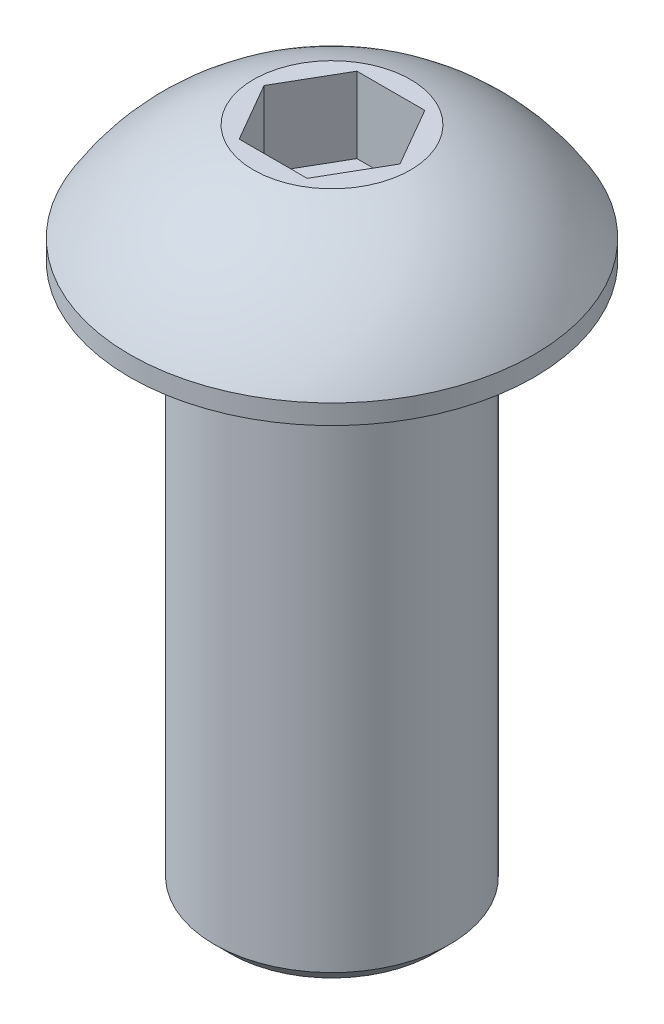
SolidWorks part; units mm, degrees
ref_plane "Front" through (0, 0, 0) normal (0, 0, 1) x (1, 0, 0)
ref_plane "Top" through (0, 0, 0) normal (0, 1, 0) x (1, 0, 0)
ref_plane "Right" through (0, 0, 0) normal (1, 0, 0) x (0, 0, -1)
sketch "Sketch1" plane through (0, 0, 0) normal (0, 0, 1) x (1, 0, 0)
  line L0 (5.15, 0) -> (0, 0)
  line L1 (0, 0) -> (0, 3)
  line L2 (0, 3) -> (2, 3)
  line L3 (5.15, 0) -> (5.15, 0.5)
  line L4 (0, 2.4641) -> (0, -1.3782) construction
  arc A0 (2, 3) -> (5.15, 0.5) centre (0.2848, -2.3957) cw
  dimension "D5" = 0.2848
  dimension "D1" = 3
  dimension "D2" = 5.15
  dimension "D3" = 2
  dimension "D4" = 0.5
revolve "Base-Revolve" add sketch "Sketch1" angle 360 about L4
sketch "Sketch2" plane through (0, 3, 0) normal (0, 1, 0) x (-1, 0, 0)
  line L0 (13.2932, 0) -> (-13.2932, 0) construction
  line L1 (0.866, -1.5) -> (1.7321, 0)
  line L2 (1.7321, 0) -> (0.866, 1.5)
  line L3 (0.866, 1.5) -> (-0.866, 1.5)
  line L4 (-0.866, 1.5) -> (-1.7321, 0)
  line L5 (-1.7321, 0) -> (-0.866, -1.5)
  line L6 (-0.866, -1.5) -> (0.866, -1.5)
  circle A0 centre (0, 0) radius 1.5 construction
  circle A1 centre (0, 0) radius 2 construction
  dimension "D1" = 3
extrude "Cut-Extrude1" cut sketch "Sketch2" against normal blind 1.9304
sketch "Sketch3" plane through (0, 0, 0) normal (0, -1, 0) x (1, 0, 0)
  circle A0 centre (0, 0) radius 3
  dimension "D1" = 6
extrude "Boss-Extrude1" add sketch "Sketch3" along normal blind 14
fillet "Fillet1" radius 0.4572 1 edges at (0, 0, 3)
chamfer "Chamfer1" distance 0.4064 angle 45 1 edges at (0, -14, -3)
